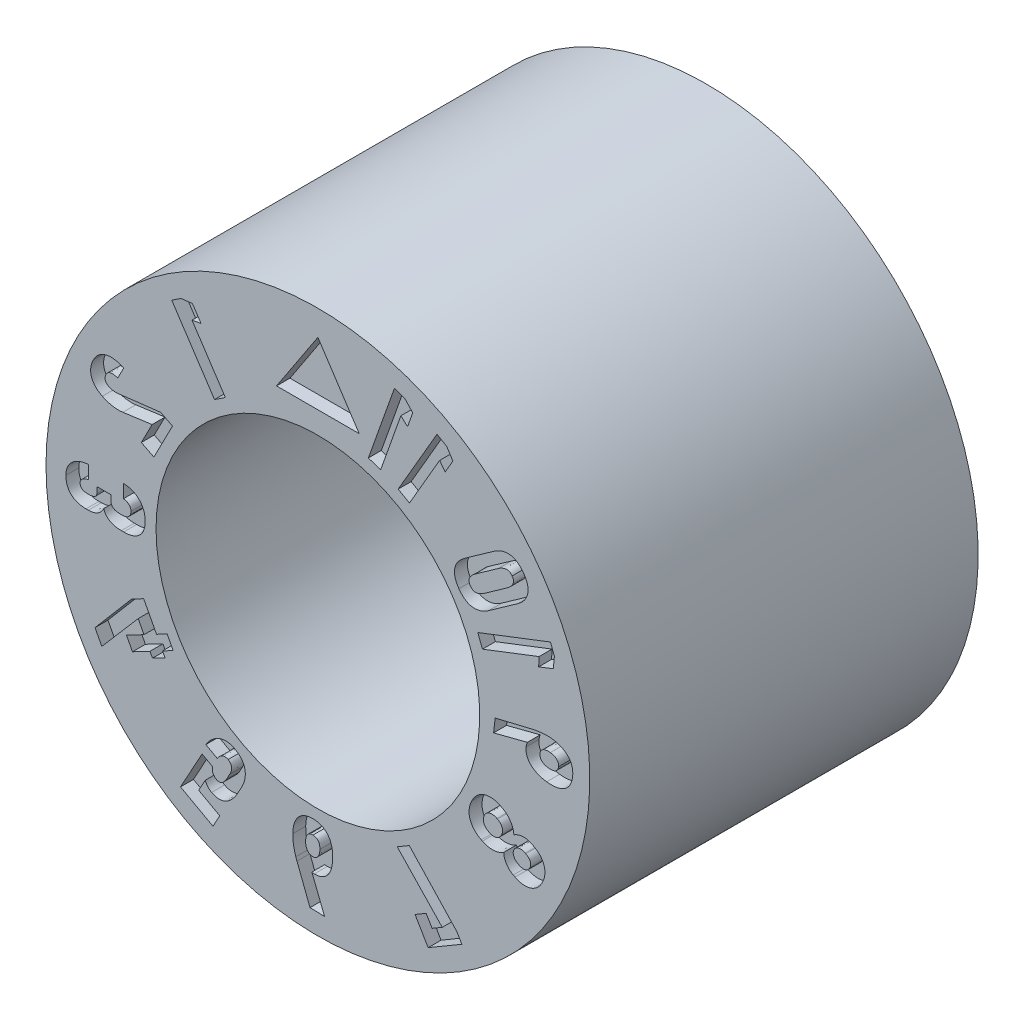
SolidWorks part; units mm, degrees
ref_plane "Front Plane" through (0, 0, 0) normal (0, 0, 1) x (1, 0, 0)
ref_plane "Top Plane" through (0, 0, 0) normal (0, 1, 0) x (1, 0, 0)
ref_plane "Right Plane" through (0, 0, 0) normal (1, 0, 0) x (0, 0, -1)
imported_body "Imported1"
other "DeleteFace1"
other "Move Face1" parameters "D1"=0.11
sketch "Sketch1" plane through (0, 0, 0) normal (0, 0, 1) x (1, 0, 0)
  line L0 (0, 0) -> (2.7878, 0) construction
  line L1 (0, 0) -> (2.4143, -1.3939) construction
  line L2 (0, 0) -> (2.4143, 1.3939) construction
  line L3 (0, 0) -> (1.3939, -2.4143) construction
  line L4 (0, 0) -> (0, -2.7878) construction
  line L5 (0, -1.65) -> (0, 1.65) construction
  line L6 (0, 0) -> (-1.3939, -2.4143) construction
  line L7 (0, 0) -> (-2.4143, -1.3939) construction
  line L8 (0, 0) -> (-2.7878, 0) construction
  line L9 (0, 0) -> (-2.4143, 1.3939) construction
  line L10 (0, 0) -> (-1.3939, 2.4143) construction
  line L11 (0, 0) -> (0, 2.7878) construction
  line L12 (0, 0) -> (1.3939, 2.4143) construction
  line L13 (1.2349, 0.5478) -> (1.2709, 0.4546)
  line L14 (1.2709, 0.4546) -> (1.7081, 0.6234)
  line L15 (1.7081, 0.6234) -> (1.7053, 0.5533)
  line L16 (1.7053, 0.5533) -> (1.8178, 0.5967)
  line L17 (1.8178, 0.5967) -> (1.827, 0.6851)
  line L18 (1.827, 0.6851) -> (1.7962, 0.7647)
  line L19 (1.7962, 0.7647) -> (1.2349, 0.5478)
  line L20 (1.3197, 0.7368) -> (1.5418, 0.8937)
  line L21 (1.3586, 1.1528) -> (1.1365, 0.9959)
  line L22 (1.2176, 0.9309) -> (1.3927, 1.0546)
  line L23 (1.4606, 0.9588) -> (1.2854, 0.835)
  line L24 (0.6203, 1.2) -> (0.7071, 1.1496)
  line L25 (0.7071, 1.1496) -> (0.9404, 1.5518)
  line L26 (0.9404, 1.5518) -> (0.9829, 1.4954)
  line L27 (0.9829, 1.4954) -> (1.0428, 1.5988)
  line L28 (1.0428, 1.5988) -> (0.9944, 1.6735)
  line L29 (0.9944, 1.6735) -> (0.9202, 1.7166)
  line L30 (0.9202, 1.7166) -> (0.6203, 1.2)
  line L31 (0.3902, 1.2932) -> (0.4843, 1.2598)
  line L32 (0.4843, 1.2598) -> (0.6409, 1.7008)
  line L33 (0.6409, 1.7008) -> (0.6925, 1.6532)
  line L34 (0.6925, 1.6532) -> (0.7327, 1.7665)
  line L35 (0.7327, 1.7665) -> (0.6717, 1.8312)
  line L36 (0.6717, 1.8312) -> (0.5913, 1.8598)
  line L37 (0.5913, 1.8598) -> (0.3902, 1.2932)
  line L38 (-0.7984, 1.0894) -> (-0.7147, 1.1448)
  line L39 (-0.7147, 1.1448) -> (-0.972, 1.5336)
  line L40 (-0.972, 1.5336) -> (-0.9026, 1.5464)
  line L41 (-0.9026, 1.5464) -> (-0.9689, 1.6464)
  line L42 (-0.9689, 1.6464) -> (-1.0574, 1.6361)
  line L43 (-1.0574, 1.6361) -> (-1.1289, 1.5889)
  line L44 (-1.1289, 1.5889) -> (-0.7984, 1.0894)
  line L45 (-1.2136, 0.796) -> (-1.5378, 0.7577)
  line L46 (-1.6147, 0.7681) -> (-1.6155, 0.7685)
  line L47 (-1.5465, 0.8592) -> (-1.5461, 0.8591)
  line L48 (-1.5461, 0.8591) -> (-1.4991, 0.9503)
  line L49 (-1.4991, 0.9503) -> (-1.4995, 0.9505)
  line L50 (-1.6655, 0.6783) -> (-1.6652, 0.6781)
  line L51 (-1.5063, 0.6503) -> (-1.2805, 0.6812)
  line L52 (-1.2805, 0.6812) -> (-1.3636, 0.5198)
  line L53 (-1.3636, 0.5198) -> (-1.2666, 0.4699)
  line L54 (-1.2666, 0.4699) -> (-1.1229, 0.7494)
  line L55 (-1.1229, 0.7494) -> (-1.2136, 0.796)
  line L56 (-1.5016, 0.177) -> (-1.5018, 0.0743)
  line L57 (-1.5123, -0.0403) -> (-1.5264, -0.0403)
  line L58 (-1.5977, 0.0082) -> (-1.5977, 0.0528)
  line L59 (-1.5977, 0.0528) -> (-1.7066, 0.053)
  line L60 (-1.7066, 0.053) -> (-1.7066, 0.0084)
  line L61 (-1.7686, -0.0311) -> (-1.779, -0.0311)
  line L62 (-1.7701, 0.0666) -> (-1.7699, 0.1689)
  line L63 (-1.7907, -0.1379) -> (-1.7726, -0.1378)
  line L64 (-1.5179, -0.147) -> (-1.4998, -0.1471)
  line L65 (-1.438, -0.5649) -> (-1.7213, -0.8975)
  line L66 (-1.7213, -0.8975) -> (-1.6689, -0.9971)
  line L67 (-1.6689, -0.9971) -> (-1.388, -0.6706)
  line L68 (-1.388, -0.6706) -> (-1.3432, -0.7557)
  line L69 (-1.2776, -0.8802) -> (-1.1808, -0.8292)
  line L70 (-1.1808, -0.8292) -> (-1.2, -0.7927)
  line L71 (-1.3456, -0.5162) -> (-1.438, -0.5649)
  line L72 (-1.4784, -0.8267) -> (-1.4321, -0.9147)
  line L73 (-1.4321, -0.9147) -> (-1.2969, -0.8436)
  line L74 (-1.1178, -0.7494) -> (-1.1641, -0.6615)
  line L75 (-1.1641, -0.6615) -> (-1.2463, -0.7047)
  line L76 (-0.8651, -1.2517) -> (-0.8654, -1.252)
  line L77 (-0.8654, -1.252) -> (-0.7774, -1.3004)
  line L78 (-0.7774, -1.3004) -> (-0.7772, -1.3001)
  line L79 (-0.6809, -1.3582) -> (-0.7052, -1.4025)
  line L80 (-0.8122, -1.3744) -> (-0.8944, -1.3293)
  line L81 (-0.8944, -1.3293) -> (-1.0611, -1.6329)
  line L82 (-1.0611, -1.6329) -> (-0.8103, -1.7706)
  line L83 (-0.8103, -1.7706) -> (-0.7577, -1.6747)
  line L84 (-0.7577, -1.6747) -> (-0.9203, -1.5853)
  line L85 (-0.9203, -1.5853) -> (-0.8691, -1.492)
  line L86 (-0.6171, -1.4508) -> (-0.5928, -1.4066)
  line L87 (-0.1941, -1.5119) -> (-0.1941, -1.5122)
  line L88 (-0.1615, -1.6796) -> (-0.0609, -1.9405)
  line L89 (-0.0609, -1.9405) -> (0.0516, -1.9433)
  line L90 (0.0516, -1.9433) -> (-0.0465, -1.6953)
  line L92 (0.1148, -1.522) -> (0.1148, -1.5217)
  line L93 (0.0155, -1.5122) -> (0.0155, -1.5126)
  line L94 (-0.0945, -1.5095) -> (-0.0945, -1.509)
  line L95 (1.0739, -1.5342) -> (0.706, -1.1419)
  line L96 (0.706, -1.1419) -> (0.6129, -1.1966)
  line L97 (0.6129, -1.1966) -> (0.9605, -1.5616)
  line L98 (0.9605, -1.5616) -> (0.8822, -1.6076)
  line L99 (0.8822, -1.6076) -> (0.8364, -1.5298)
  line L100 (0.8364, -1.5298) -> (0.7505, -1.5802)
  line L101 (0.7505, -1.5802) -> (0.8514, -1.752)
  line L102 (0.8514, -1.752) -> (1.1119, -1.599)
  line L103 (1.1119, -1.599) -> (1.0739, -1.5342)
  line L104 (1.262, -0.8252) -> (1.2708, -0.8296)
  line L105 (1.5092, -0.9373) -> (1.5231, -0.9443)
  line L106 (1.6641, -0.6641) -> (1.6502, -0.657)
  line L107 (1.4217, -0.5298) -> (1.4129, -0.5253)
  line L108 (1.3827, -0.6219) -> (1.3878, -0.6245)
  line L109 (1.3263, -0.7459) -> (1.3208, -0.7431)
  line L110 (1.6013, -0.7441) -> (1.6064, -0.7467)
  line L111 (1.5548, -0.8486) -> (1.5493, -0.8459)
  line L113 (1.7668, -0.1844) -> (1.7672, -0.1845)
  line L114 (1.8017, 0.1247) -> (1.8013, 0.1248)
  line L115 (1.6354, 0.1068) -> (1.3695, 0.0428)
  line L116 (1.3695, 0.0428) -> (1.357, -0.0625)
  line L117 (1.357, -0.0625) -> (1.618, 0.0049)
  line L118 (1.7948, 0.0247) -> (1.7953, 0.0246)
  line L119 (1.7818, -0.0853) -> (1.7815, -0.0853)
  line L120 (-1.3432, -0.7557) -> (-1.4784, -0.8267)
  line L121 (-1.2463, -0.7047) -> (-1.3456, -0.5162)
  line L122 (-1.2969, -0.8436) -> (-1.2776, -0.8802)
  line L123 (-1.2, -0.7927) -> (-1.1178, -0.7494)
  circle A0 centre (0, 0) radius 1.355 construction
  spline S0 degree 3 poles (1.0892, 0.7682) (1.0962, 0.7582) (1.1077, 0.7444) (1.1246, 0.7284) (1.1376, 0.7188) (1.151, 0.7106) (1.165, 0.7046) (1.1794, 0.7) (1.1942, 0.6974) (1.2094, 0.6964) (1.2248, 0.6973) (1.2403, 0.6998) (1.256, 0.7037) (1.2718, 0.7097) (1.2937, 0.7196) (1.3093, 0.7296) (1.3197, 0.7368) knots 0 0 0 0 0.138223 0.202127 0.26303 0.321891 0.378837 0.435678 0.492307 0.549453 0.60742 0.666308 0.727523 0.790486 0.856773 1 1 1 1
  spline S1 degree 3 poles (1.5418, 0.8937) (1.5522, 0.901) (1.5667, 0.9127) (1.5837, 0.93) (1.5945, 0.943) (1.6036, 0.9565) (1.6111, 0.9703) (1.6168, 0.9846) (1.6209, 0.9991) (1.6234, 1.014) (1.6238, 1.029) (1.6226, 1.0442) (1.6195, 1.0595) (1.6146, 1.0749) (1.6053, 1.0961) (1.596, 1.1113) (1.589, 1.1213) knots 0 0 0 0 0.143936 0.210679 0.274525 0.335577 0.39443 0.45221 0.50914 0.565942 0.622178 0.679438 0.738053 0.798374 0.8621 1 1 1 1
  spline S2 degree 3 poles (1.589, 1.1213) (1.5819, 1.1312) (1.5708, 1.1453) (1.5536, 1.1609) (1.5408, 1.1709) (1.5274, 1.1788) (1.5136, 1.1853) (1.4992, 1.1897) (1.4845, 1.1925) (1.4694, 1.1935) (1.4541, 1.1928) (1.4386, 1.1903) (1.4229, 1.1862) (1.407, 1.1804) (1.3849, 1.1701) (1.369, 1.1602) (1.3586, 1.1528) knots 0 0 0 0 0.138285 0.201935 0.262466 0.32126 0.378216 0.434531 0.491022 0.547533 0.605259 0.664079 0.724843 0.788739 0.855272 1 1 1 1
  spline S3 degree 3 poles (1.1365, 0.9959) (1.1262, 0.9885) (1.1115, 0.9769) (1.0944, 0.9597) (1.0838, 0.9465) (1.0745, 0.9332) (1.0671, 0.9193) (1.0614, 0.9051) (1.0572, 0.8905) (1.055, 0.8756) (1.0543, 0.8606) (1.0556, 0.8454) (1.0588, 0.8301) (1.0636, 0.8146) (1.0729, 0.7934) (1.0822, 0.7781) (1.0892, 0.7682) knots 0 0 0 0 0.144056 0.21075 0.274393 0.335517 0.394327 0.452064 0.508951 0.565796 0.621851 0.679069 0.737879 0.798524 0.862202 1 1 1 1
  spline S4 degree 3 poles (1.1779, 0.8309) (1.1725, 0.8381) (1.1671, 0.8507) (1.1669, 0.8685) (1.171, 0.8813) (1.1781, 0.894) (1.193, 0.9117) (1.2069, 0.9236) (1.2176, 0.9309) knots 0 0 0 0 0.222988 0.325304 0.431966 0.550057 0.682242 1 1 1 1
  spline S5 degree 3 poles (1.3927, 1.0546) (1.4033, 1.0621) (1.419, 1.0715) (1.4407, 1.0794) (1.455, 1.082) (1.4684, 1.0814) (1.4853, 1.0756) (1.4951, 1.0659) (1.5003, 1.0586) knots 0 0 0 0 0.31819 0.449664 0.567045 0.673853 0.777329 1 1 1 1
  spline S6 degree 3 poles (1.5003, 1.0586) (1.5054, 1.0513) (1.5114, 1.0389) (1.5111, 1.0211) (1.5072, 1.0083) (1.5, 0.9957) (1.4854, 0.9778) (1.4711, 0.9662) (1.4606, 0.9588) knots 0 0 0 0 0.222263 0.325328 0.432124 0.549372 0.681391 1 1 1 1
  spline S7 degree 3 poles (1.2854, 0.835) (1.275, 0.8274) (1.2592, 0.8182) (1.2375, 0.8101) (1.2231, 0.8076) (1.2097, 0.808) (1.193, 0.8142) (1.1829, 0.8233) (1.1779, 0.8309) knots 0 0 0 0 0.317667 0.449809 0.568102 0.674939 0.777435 1 1 1 1
  spline S8 degree 3 poles (-1.5378, 0.7577) (-1.5518, 0.7557) (-1.5782, 0.756) (-1.6038, 0.7625) (-1.6147, 0.7681) knots 0 0 0 0 0.536413 1 1 1 1
  spline S9 degree 3 poles (-1.6155, 0.7685) (-1.622, 0.7717) (-1.6307, 0.778) (-1.639, 0.7891) (-1.6427, 0.798) (-1.6445, 0.8077) (-1.6435, 0.8219) (-1.6398, 0.8324) (-1.6361, 0.8392) knots 0 0 0 0 0.262133 0.377529 0.491277 0.606256 0.725784 1 1 1 1
  spline S10 degree 3 poles (-1.6361, 0.8392) (-1.6326, 0.846) (-1.6255, 0.8554) (-1.6123, 0.8632) (-1.6012, 0.867) (-1.5889, 0.8683) (-1.5701, 0.8674) (-1.5559, 0.863) (-1.5465, 0.8592) knots 0 0 0 0 0.226016 0.335638 0.448497 0.568894 0.698891 1 1 1 1
  spline S11 degree 3 poles (-1.4995, 0.9505) (-1.5156, 0.9576) (-1.5399, 0.9662) (-1.5728, 0.9723) (-1.596, 0.9739) (-1.6181, 0.9726) (-1.6391, 0.9687) (-1.6586, 0.9618) (-1.6769, 0.9525) (-1.6936, 0.9404) (-1.7141, 0.9207) (-1.726, 0.9025) (-1.7327, 0.8896) knots 0 0 0 0 0.195848 0.285789 0.371983 0.454027 0.532482 0.608665 0.684401 0.760712 0.837413 1 1 1 1
  spline S12 degree 3 poles (-1.7327, 0.8896) (-1.7398, 0.8758) (-1.7484, 0.8549) (-1.7543, 0.8262) (-1.7557, 0.8059) (-1.7541, 0.7863) (-1.7499, 0.7675) (-1.7425, 0.7498) (-1.7325, 0.733) (-1.7197, 0.7173) (-1.6983, 0.6973) (-1.6791, 0.6854) (-1.6655, 0.6783) knots 0 0 0 0 0.184113 0.267875 0.3479 0.425373 0.501068 0.576279 0.653203 0.732927 0.816573 1 1 1 1
  spline S13 degree 3 poles (-1.6652, 0.6781) (-1.653, 0.672) (-1.6341, 0.6639) (-1.6076, 0.6564) (-1.5872, 0.6521) (-1.5667, 0.6492) (-1.5397, 0.6474) (-1.5195, 0.6486) (-1.5063, 0.6503) knots 0 0 0 0 0.249843 0.375892 0.503883 0.63129 0.755593 1 1 1 1
  spline S14 degree 3 poles (-1.3339, 0.0076) (-1.3339, 0.0228) (-1.336, 0.0453) (-1.3446, 0.0736) (-1.3531, 0.0931) (-1.3642, 0.1109) (-1.3776, 0.127) (-1.3934, 0.141) (-1.4112, 0.1531) (-1.4311, 0.163) (-1.4611, 0.1731) (-1.4851, 0.1764) (-1.5016, 0.177) knots 0 0 0 0 0.170896 0.251912 0.331279 0.409717 0.487098 0.56533 0.645898 0.729093 0.814579 1 1 1 1
  spline S15 degree 3 poles (-1.5018, 0.0743) (-1.496, 0.0737) (-1.4876, 0.072) (-1.4772, 0.0682) (-1.4703, 0.0649) (-1.4642, 0.0608) (-1.4588, 0.0563) (-1.4543, 0.0512) (-1.4505, 0.0456) (-1.4474, 0.0396) (-1.4444, 0.0307) (-1.4439, 0.0235) (-1.4438, 0.0187) knots 0 0 0 0 0.197909 0.287083 0.372576 0.454959 0.534016 0.609962 0.685107 0.760753 0.837726 1 1 1 1
  spline S16 degree 3 poles (-1.4438, 0.0187) (-1.4439, 0.0103) (-1.4455, -0.0025) (-1.4537, -0.0167) (-1.4617, -0.0253) (-1.4717, -0.0323) (-1.4885, -0.039) (-1.5026, -0.0404) (-1.5123, -0.0403) knots 0 0 0 0 0.250242 0.36225 0.475241 0.591574 0.715469 1 1 1 1
  spline S17 degree 3 poles (-1.5264, -0.0403) (-1.5366, -0.0403) (-1.5511, -0.0389) (-1.5688, -0.0337) (-1.5792, -0.0281) (-1.5875, -0.0211) (-1.5957, -0.0096) (-1.5976, 0.0012) (-1.5977, 0.0082) knots 0 0 0 0 0.314522 0.447609 0.567651 0.676685 0.781535 1 1 1 1
  spline S18 degree 3 poles (-1.7066, 0.0084) (-1.7066, 0.0026) (-1.7084, -0.0063) (-1.7158, -0.0155) (-1.7231, -0.0213) (-1.7322, -0.0257) (-1.7473, -0.0303) (-1.7599, -0.031) (-1.7686, -0.0311) knots 0 0 0 0 0.21249 0.315264 0.426132 0.547677 0.681544 1 1 1 1
  spline S19 degree 3 poles (-1.779, -0.0311) (-1.7872, -0.0311) (-1.799, -0.03) (-1.8133, -0.0251) (-1.8217, -0.02) (-1.8285, -0.0137) (-1.8349, -0.0031) (-1.8366, 0.0063) (-1.8366, 0.0125) knots 0 0 0 0 0.301764 0.431917 0.550739 0.661887 0.769431 1 1 1 1
  spline S20 degree 3 poles (-1.8366, 0.0125) (-1.8364, 0.0168) (-1.8357, 0.0234) (-1.8323, 0.0315) (-1.8289, 0.0372) (-1.8243, 0.0424) (-1.8191, 0.0474) (-1.8129, 0.0519) (-1.8059, 0.0559) (-1.798, 0.0593) (-1.7862, 0.0635) (-1.7767, 0.0656) (-1.7701, 0.0666) knots 0 0 0 0 0.139151 0.208417 0.280019 0.353416 0.429325 0.510733 0.596934 0.688894 0.786176 1 1 1 1
  spline S21 degree 3 poles (-1.7699, 0.1689) (-1.7872, 0.1676) (-1.8123, 0.1635) (-1.8437, 0.1534) (-1.8647, 0.1437) (-1.8835, 0.1321) (-1.9, 0.1187) (-1.9142, 0.1038) (-1.9259, 0.0872) (-1.9351, 0.0692) (-1.9439, 0.0434) (-1.9464, 0.023) (-1.9464, 0.0092) knots 0 0 0 0 0.196705 0.287497 0.374502 0.458146 0.537777 0.615099 0.691922 0.768133 0.843843 1 1 1 1
  spline S22 degree 3 poles (-1.9464, 0.0092) (-1.9464, -0.0018) (-1.9452, -0.018) (-1.9411, -0.0387) (-1.9366, -0.0529) (-1.9309, -0.066) (-1.924, -0.0782) (-1.9157, -0.0893) (-1.9062, -0.0995) (-1.8954, -0.1084) (-1.8837, -0.1164) (-1.8707, -0.1229) (-1.8568, -0.1284) (-1.8417, -0.1326) (-1.8196, -0.1367) (-1.8024, -0.138) (-1.7907, -0.1379) knots 0 0 0 0 0.13603 0.199111 0.259727 0.317908 0.375227 0.431827 0.488613 0.545983 0.603875 0.662892 0.724206 0.788237 0.855063 1 1 1 1
  spline S23 degree 3 poles (-1.7726, -0.1378) (-1.7595, -0.1379) (-1.7401, -0.1359) (-1.716, -0.1279) (-1.6998, -0.1199) (-1.6852, -0.1096) (-1.668, -0.0931) (-1.6584, -0.0779) (-1.6536, -0.067) knots 0 0 0 0 0.26804 0.392811 0.516031 0.6366 0.756097 1 1 1 1
  spline S24 degree 3 poles (-1.6536, -0.067) (-1.6519, -0.0731) (-1.6488, -0.0822) (-1.6427, -0.0932) (-1.6375, -0.1009) (-1.6314, -0.1081) (-1.6244, -0.1147) (-1.6167, -0.1208) (-1.6053, -0.1281) (-1.5891, -0.1359) (-1.5591, -0.1449) (-1.5347, -0.147) (-1.5179, -0.147) knots 0 0 0 0 0.112565 0.167519 0.221693 0.276675 0.33305 0.390355 0.449112 0.572434 0.704406 1 1 1 1
  spline S25 degree 3 poles (-1.4998, -0.1471) (-1.4835, -0.1472) (-1.4597, -0.1452) (-1.4299, -0.1376) (-1.4103, -0.1296) (-1.3927, -0.1195) (-1.3771, -0.1073) (-1.364, -0.0927) (-1.353, -0.0762) (-1.3445, -0.0578) (-1.3361, -0.03) (-1.3338, -0.0077) (-1.3339, 0.0076) knots 0 0 0 0 0.189935 0.275883 0.357541 0.435557 0.511486 0.586723 0.662764 0.741079 0.822267 1 1 1 1
  spline S26 degree 3 poles (-0.6416, -1.1688) (-0.6536, -1.1621) (-0.6727, -1.1546) (-0.6995, -1.1502) (-0.7196, -1.1501) (-0.7397, -1.1526) (-0.7595, -1.1582) (-0.779, -1.1669) (-0.798, -1.1783) (-0.8164, -1.1927) (-0.8405, -1.2159) (-0.8557, -1.2369) (-0.8651, -1.2517) knots 0 0 0 0 0.155333 0.230429 0.305726 0.3816 0.45859 0.537853 0.621767 0.70927 0.801016 1 1 1 1
  spline S27 degree 3 poles (-0.7772, -1.3001) (-0.7715, -1.2919) (-0.7625, -1.2803) (-0.7478, -1.2691) (-0.7369, -1.2632) (-0.7259, -1.2599) (-0.7108, -1.259) (-0.6999, -1.2625) (-0.6934, -1.2662) knots 0 0 0 0 0.301173 0.432188 0.553374 0.667676 0.775283 1 1 1 1
  spline S28 degree 3 poles (-0.6934, -1.2662) (-0.6864, -1.27) (-0.677, -1.2777) (-0.6694, -1.2916) (-0.6666, -1.3031) (-0.6662, -1.3157) (-0.6695, -1.3349) (-0.6759, -1.3488) (-0.6809, -1.3582) knots 0 0 0 0 0.229435 0.335811 0.447576 0.566804 0.694862 1 1 1 1
  spline S29 degree 3 poles (-0.7052, -1.4025) (-0.7103, -1.4117) (-0.7185, -1.4244) (-0.7322, -1.4377) (-0.7424, -1.4445) (-0.7529, -1.4486) (-0.7673, -1.4504) (-0.7779, -1.4472) (-0.7842, -1.4437) knots 0 0 0 0 0.316378 0.449605 0.57057 0.680314 0.784691 1 1 1 1
  spline S30 degree 3 poles (-0.7842, -1.4437) (-0.7901, -1.4404) (-0.7982, -1.4343) (-0.8063, -1.4238) (-0.8108, -1.4151) (-0.8137, -1.4057) (-0.8153, -1.392) (-0.814, -1.3814) (-0.8122, -1.3744) knots 0 0 0 0 0.251267 0.369614 0.489467 0.610079 0.733785 1 1 1 1
  spline S31 degree 3 poles (-0.8691, -1.492) (-0.8678, -1.4977) (-0.8643, -1.506) (-0.8578, -1.5165) (-0.8516, -1.5243) (-0.8447, -1.5317) (-0.8346, -1.5403) (-0.8267, -1.5462) (-0.8209, -1.5492) knots 0 0 0 0 0.227476 0.350034 0.481159 0.615689 0.745113 1 1 1 1
  spline S32 degree 3 poles (-0.8209, -1.5492) (-0.8096, -1.5556) (-0.7916, -1.5626) (-0.7666, -1.5658) (-0.7483, -1.565) (-0.7301, -1.5611) (-0.7124, -1.5539) (-0.695, -1.544) (-0.678, -1.5309) (-0.6617, -1.5149) (-0.6398, -1.489) (-0.6259, -1.4667) (-0.6171, -1.4508) knots 0 0 0 0 0.152434 0.223905 0.294747 0.366754 0.440898 0.518614 0.602294 0.691848 0.787174 1 1 1 1
  spline S33 degree 3 poles (-0.5928, -1.4066) (-0.5843, -1.3906) (-0.573, -1.3665) (-0.564, -1.3336) (-0.5604, -1.3105) (-0.5601, -1.2883) (-0.5628, -1.2672) (-0.5683, -1.2472) (-0.5773, -1.2285) (-0.5889, -1.2111) (-0.6091, -1.1892) (-0.6279, -1.1762) (-0.6416, -1.1688) knots 0 0 0 0 0.197821 0.287444 0.371532 0.451748 0.528265 0.602902 0.677238 0.752783 0.830864 1 1 1 1
  spline S34 degree 3 poles (-0.0351, -1.3345) (-0.0503, -1.3342) (-0.0727, -1.3358) (-0.1005, -1.3443) (-0.1192, -1.3532) (-0.136, -1.3647) (-0.1507, -1.3789) (-0.1634, -1.3955) (-0.174, -1.4145) (-0.1826, -1.4358) (-0.191, -1.4682) (-0.1938, -1.4941) (-0.1941, -1.5119) knots 0 0 0 0 0.168615 0.246655 0.322409 0.397008 0.471617 0.548082 0.628446 0.71276 0.80207 1 1 1 1
  spline S35 degree 3 poles (-0.1941, -1.5122) (-0.1944, -1.5235) (-0.1938, -1.5406) (-0.1914, -1.5636) (-0.186, -1.6005) (-0.1781, -1.6309) (-0.1703, -1.6549) knots 0 0 0 0 0.231469 0.353254 0.478549 1 1 1 1
  spline S36 degree 3 poles (-0.1703, -1.6549) (-0.169, -1.6591) (-0.1663, -1.6674) (-0.1631, -1.6756) (-0.1615, -1.6796) knots 0 0 0 0 0.505047 1 1 1 1
  spline S37 degree 3 poles (-0.0465, -1.6953) (-0.0402, -1.6969) (-0.0337, -1.6976) (-0.0273, -1.6978) knots 0.767397 0.767397 0.767397 0.767397 1 1 1 1
  spline S38 degree 3 poles (-0.0273, -1.6978) (-0.0137, -1.6979) (0.0065, -1.6964) (0.0313, -1.6878) (0.048, -1.6791) (0.0629, -1.6675) (0.0761, -1.6536) (0.0873, -1.6371) (0.0969, -1.6183) (0.1044, -1.5972) (0.112, -1.5651) (0.1145, -1.5396) (0.1148, -1.522) knots 0 0 0 0 0.159667 0.233925 0.306854 0.379802 0.454098 0.531626 0.613414 0.700878 0.793849 1 1 1 1
  spline S39 degree 3 poles (0.1148, -1.5217) (0.1151, -1.5037) (0.1141, -1.4775) (0.107, -1.4443) (0.0997, -1.4223) (0.0901, -1.4025) (0.0783, -1.3851) (0.0643, -1.37) (0.0481, -1.3576) (0.03, -1.3477) (0.0025, -1.3377) (-0.0199, -1.335) (-0.0351, -1.3345) knots 0 0 0 0 0.198288 0.288134 0.372689 0.45337 0.530054 0.604439 0.678751 0.75414 0.831768 1 1 1 1
  spline S40 degree 3 poles (-0.0379, -1.4435) (-0.03, -1.4438) (-0.0182, -1.4458) (-0.005, -1.4538) (0.0029, -1.4619) (0.0089, -1.472) (0.0148, -1.4887) (0.0157, -1.5026) (0.0155, -1.5122) knots 0 0 0 0 0.242212 0.353714 0.465125 0.582029 0.707045 1 1 1 1
  spline S41 degree 3 poles (0.0155, -1.5126) (0.015, -1.5236) (0.0137, -1.5394) (0.0069, -1.5583) (0.0003, -1.5694) (-0.008, -1.5782) (-0.0215, -1.5867) (-0.0335, -1.5887) (-0.0415, -1.5884) knots 0 0 0 0 0.309863 0.44026 0.5593 0.669422 0.775237 1 1 1 1
  spline S42 degree 3 poles (-0.0415, -1.5884) (-0.0494, -1.5882) (-0.0614, -1.5856) (-0.0743, -1.5763) (-0.0821, -1.567) (-0.088, -1.5553) (-0.094, -1.5362) (-0.0947, -1.5204) (-0.0945, -1.5095) knots 0 0 0 0 0.22383 0.329704 0.44126 0.562179 0.692715 1 1 1 1
  spline S43 degree 3 poles (-0.0945, -1.509) (-0.0941, -1.4995) (-0.0928, -1.4856) (-0.0858, -1.4694) (-0.0793, -1.4597) (-0.0711, -1.4521) (-0.0575, -1.4449) (-0.0458, -1.4433) (-0.0379, -1.4435) knots 0 0 0 0 0.293582 0.418522 0.535378 0.64724 0.757896 1 1 1 1
  spline S44 degree 3 poles (1.1891, -0.6007) (1.1821, -0.6148) (1.1733, -0.6366) (1.1682, -0.6668) (1.1673, -0.6885) (1.1694, -0.7097) (1.1743, -0.7301) (1.1822, -0.7495) (1.193, -0.7678) (1.2065, -0.7847) (1.2283, -0.8058) (1.248, -0.8181) (1.262, -0.8252) knots 0 0 0 0 0.178767 0.26231 0.343711 0.423484 0.501763 0.579575 0.659063 0.740005 0.822973 1 1 1 1
  spline S45 degree 3 poles (1.2708, -0.8296) (1.2839, -0.8363) (1.3047, -0.8436) (1.3337, -0.848) (1.3558, -0.8484) (1.3776, -0.8463) (1.405, -0.8396) (1.424, -0.8306) (1.4353, -0.8227) knots 0 0 0 0 0.254636 0.381088 0.510113 0.638025 0.760467 1 1 1 1
  spline S46 degree 3 poles (1.4353, -0.8227) (1.4359, -0.8344) (1.4386, -0.852) (1.4475, -0.8741) (1.4564, -0.89) (1.4672, -0.9045) (1.4836, -0.922) (1.4987, -0.9318) (1.5092, -0.9373) knots 0 0 0 0 0.246648 0.370601 0.498328 0.626727 0.750949 1 1 1 1
  spline S47 degree 3 poles (1.5231, -0.9443) (1.5364, -0.9508) (1.5567, -0.959) (1.585, -0.9636) (1.6053, -0.9645) (1.6252, -0.9624) (1.6443, -0.9578) (1.6625, -0.9501) (1.6797, -0.94) (1.6956, -0.9272) (1.7156, -0.9067) (1.7271, -0.888) (1.7339, -0.8748) knots 0 0 0 0 0.177767 0.260809 0.342261 0.42189 0.499758 0.577839 0.657534 0.738804 0.822133 1 1 1 1
  spline S48 degree 3 poles (1.7339, -0.8748) (1.7405, -0.8616) (1.7484, -0.8411) (1.7534, -0.8129) (1.7539, -0.7925) (1.7518, -0.7726) (1.7471, -0.7535) (1.7394, -0.7353) (1.7293, -0.7181) (1.7165, -0.7021) (1.6958, -0.6824) (1.6773, -0.6707) (1.6641, -0.6641) knots 0 0 0 0 0.177744 0.261113 0.34262 0.421977 0.500273 0.578331 0.658002 0.739248 0.822634 1 1 1 1
  spline S49 degree 3 poles (1.6502, -0.657) (1.6394, -0.6517) (1.6222, -0.6455) (1.5982, -0.6427) (1.58, -0.643) (1.5621, -0.6455) (1.5391, -0.652) (1.5233, -0.6603) (1.5136, -0.6671) knots 0 0 0 0 0.251473 0.376684 0.503505 0.630303 0.753905 1 1 1 1
  spline S50 degree 3 poles (1.5136, -0.6671) (1.5132, -0.6531) (1.509, -0.6323) (1.4981, -0.606) (1.4871, -0.5871) (1.4737, -0.5695) (1.453, -0.5487) (1.4347, -0.5363) (1.4217, -0.5298) knots 0 0 0 0 0.241916 0.365025 0.492356 0.620331 0.746803 1 1 1 1
  spline S51 degree 3 poles (1.4129, -0.5253) (1.3988, -0.5183) (1.3771, -0.51) (1.3472, -0.5048) (1.3256, -0.5041) (1.3046, -0.5064) (1.2843, -0.5115) (1.265, -0.5197) (1.2468, -0.5306) (1.2297, -0.5443) (1.2088, -0.5666) (1.1961, -0.5864) (1.1891, -0.6007) knots 0 0 0 0 0.177196 0.260073 0.340885 0.420174 0.498087 0.575661 0.655544 0.737406 0.820967 1 1 1 1
  spline S52 degree 3 poles (1.286, -0.6494) (1.2888, -0.6437) (1.294, -0.6358) (1.3028, -0.627) (1.3101, -0.6216) (1.318, -0.6175) (1.3264, -0.6143) (1.3352, -0.6126) (1.3445, -0.6118) (1.354, -0.6125) (1.367, -0.615) (1.3765, -0.6188) (1.3827, -0.6219) knots 0 0 0 0 0.168353 0.249264 0.329295 0.408066 0.485761 0.565602 0.647225 0.730865 0.817365 1 1 1 1
  spline S53 degree 3 poles (1.3878, -0.6245) (1.3934, -0.6274) (1.4015, -0.6323) (1.4103, -0.6408) (1.4158, -0.6477) (1.42, -0.6552) (1.4234, -0.663) (1.4252, -0.6714) (1.4263, -0.6799) (1.4258, -0.6887) (1.4238, -0.7009) (1.4204, -0.7098) (1.4175, -0.7155) knots 0 0 0 0 0.177161 0.259926 0.340463 0.420351 0.498728 0.576447 0.65619 0.737648 0.821047 1 1 1 1
  spline S54 degree 3 poles (1.4175, -0.7155) (1.4147, -0.7214) (1.4094, -0.7292) (1.401, -0.7383) (1.3941, -0.7437) (1.3867, -0.7482) (1.3788, -0.7514) (1.3705, -0.7535) (1.3619, -0.7544) (1.353, -0.754) (1.3407, -0.7524) (1.332, -0.7485) (1.3263, -0.7459) knots 0 0 0 0 0.177834 0.261678 0.341995 0.421543 0.499706 0.577819 0.657912 0.740031 0.823187 1 1 1 1
  spline S55 degree 3 poles (1.3208, -0.7431) (1.3147, -0.74) (1.3059, -0.7347) (1.2963, -0.7256) (1.2902, -0.7184) (1.2852, -0.7107) (1.2817, -0.7024) (1.2791, -0.694) (1.278, -0.6851) (1.2781, -0.6762) (1.2798, -0.6639) (1.2832, -0.6551) (1.286, -0.6494) knots 0 0 0 0 0.183224 0.269491 0.353488 0.435313 0.513479 0.592347 0.670801 0.750051 0.830878 1 1 1 1
  spline S56 degree 3 poles (1.5151, -0.7647) (1.5175, -0.7598) (1.5219, -0.7531) (1.5297, -0.7459) (1.536, -0.7415) (1.543, -0.7383) (1.5503, -0.7358) (1.5582, -0.7347) (1.5665, -0.7343) (1.575, -0.7352) (1.587, -0.7377) (1.5957, -0.7412) (1.6013, -0.7441) knots 0 0 0 0 0.163179 0.239801 0.317206 0.393552 0.471221 0.550322 0.63343 0.719507 0.808232 1 1 1 1
  spline S57 degree 3 poles (1.6064, -0.7467) (1.6117, -0.7494) (1.6193, -0.7539) (1.6277, -0.7617) (1.633, -0.7677) (1.6372, -0.7743) (1.6405, -0.7811) (1.6425, -0.7883) (1.6438, -0.7957) (1.6437, -0.8033) (1.6423, -0.8137) (1.6394, -0.8212) (1.637, -0.826) knots 0 0 0 0 0.186678 0.273845 0.357107 0.437732 0.517133 0.593519 0.671207 0.750649 0.831031 1 1 1 1
  spline S58 degree 3 poles (1.637, -0.826) (1.6345, -0.8308) (1.6303, -0.8377) (1.6227, -0.8448) (1.6167, -0.8494) (1.61, -0.8528) (1.603, -0.8556) (1.5955, -0.8568) (1.5877, -0.8573) (1.5796, -0.8567) (1.5683, -0.8545) (1.5601, -0.8513) (1.5548, -0.8486) knots 0 0 0 0 0.168671 0.24844 0.326278 0.403696 0.482045 0.560227 0.64234 0.726491 0.813185 1 1 1 1
  spline S59 degree 3 poles (1.5493, -0.8459) (1.5438, -0.843) (1.5358, -0.8383) (1.5268, -0.8303) (1.5212, -0.8239) (1.5164, -0.8172) (1.5129, -0.8101) (1.5104, -0.8028) (1.509, -0.7953) (1.5085, -0.7876) (1.51, -0.7771) (1.5125, -0.7695) (1.5151, -0.7647) knots 0 0 0 0 0.188826 0.278508 0.364103 0.446941 0.525978 0.603757 0.680589 0.758054 0.834974 1 1 1 1
  spline S60 degree 3 poles (1.618, 0.0049) (1.6178, 0.0044) (1.616, 0.0007) (1.6117, -0.0106) (1.6092, -0.0219) (1.6084, -0.0298) knots 0.574202 0.574202 0.574202 0.574202 0.59206 0.721434 1 1 1 1
  spline S61 degree 3 poles (1.6084, -0.0298) (1.6069, -0.0424) (1.6072, -0.0616) (1.6138, -0.0859) (1.6214, -0.1029) (1.6319, -0.1186) (1.6446, -0.1332) (1.6599, -0.146) (1.6775, -0.1574) (1.6972, -0.1672) (1.7268, -0.1778) (1.7505, -0.1824) (1.7668, -0.1844) knots 0 0 0 0 0.154127 0.22826 0.303113 0.378805 0.455953 0.535993 0.6202 0.708707 0.800995 1 1 1 1
  spline S62 degree 3 poles (1.7672, -0.1845) (1.7851, -0.1866) (1.8113, -0.1879) (1.845, -0.1838) (1.8675, -0.1785) (1.8881, -0.1707) (1.9066, -0.1605) (1.9228, -0.1477) (1.9367, -0.1327) (1.9482, -0.1154) (1.9607, -0.0887) (1.9657, -0.0666) (1.9675, -0.0513) knots 0 0 0 0 0.197835 0.287295 0.371855 0.451764 0.528497 0.60316 0.677575 0.752984 0.830748 1 1 1 1
  spline S63 degree 3 poles (1.9675, -0.0513) (1.9694, -0.0361) (1.9695, -0.0136) (1.9635, 0.0152) (1.9562, 0.0346) (1.9459, 0.0524) (1.9331, 0.0687) (1.9173, 0.083) (1.8989, 0.0954) (1.878, 0.106) (1.8458, 0.1176) (1.8197, 0.1225) (1.8017, 0.1247) knots 0 0 0 0 0.167077 0.244691 0.319793 0.39395 0.468636 0.545498 0.626109 0.710934 0.80118 1 1 1 1
  spline S64 degree 3 poles (1.8013, 0.1248) (1.7909, 0.126) (1.775, 0.1268) (1.7532, 0.1263) (1.7358, 0.1249) (1.7176, 0.1227) (1.6918, 0.119) (1.6722, 0.115) (1.6588, 0.1123) knots 0 0 0 0 0.218079 0.333469 0.45511 0.582202 0.715101 1 1 1 1
  spline S65 degree 3 poles (1.6588, 0.1123) (1.6549, 0.1113) (1.6469, 0.1102) (1.6392, 0.1077) (1.6354, 0.1068) knots 0 0 0 0 0.504542 1 1 1 1
  spline S66 degree 3 poles (1.7156, -0.0214) (1.7163, -0.0135) (1.72, -0.002) (1.7298, 0.0102) (1.7393, 0.0173) (1.7507, 0.0224) (1.7694, 0.0262) (1.7844, 0.0262) (1.7948, 0.0247) knots 0 0 0 0 0.23128 0.338434 0.449944 0.569383 0.698158 1 1 1 1
  spline S67 degree 3 poles (1.7953, 0.0246) (1.8052, 0.0234) (1.8195, 0.0205) (1.8359, 0.0122) (1.8455, 0.0047) (1.8527, -0.0043) (1.8593, -0.0185) (1.8595, -0.0305) (1.8588, -0.0384) knots 0 0 0 0 0.297704 0.425701 0.542939 0.654786 0.763987 1 1 1 1
  spline S68 degree 3 poles (1.8588, -0.0384) (1.8579, -0.0464) (1.8545, -0.0581) (1.8447, -0.0704) (1.8355, -0.0775) (1.8245, -0.0827) (1.8064, -0.0868) (1.7918, -0.0866) (1.7818, -0.0853) knots 0 0 0 0 0.23817 0.346471 0.458199 0.576664 0.703143 1 1 1 1
  spline S69 degree 3 poles (1.7815, -0.0853) (1.7712, -0.084) (1.7564, -0.0811) (1.7393, -0.0726) (1.7294, -0.0651) (1.722, -0.056) (1.7152, -0.0417) (1.7146, -0.0295) (1.7156, -0.0214) knots 0 0 0 0 0.301141 0.429471 0.54708 0.658081 0.765367 1 1 1 1
  point P21 (0, 0)
  dimension "D1" = 2.71
  dimension "D2" = 12
  dimension "D3" = 60
extrude "Cut-Extrude1" cut sketch "Sketch1" against normal blind 0.1
